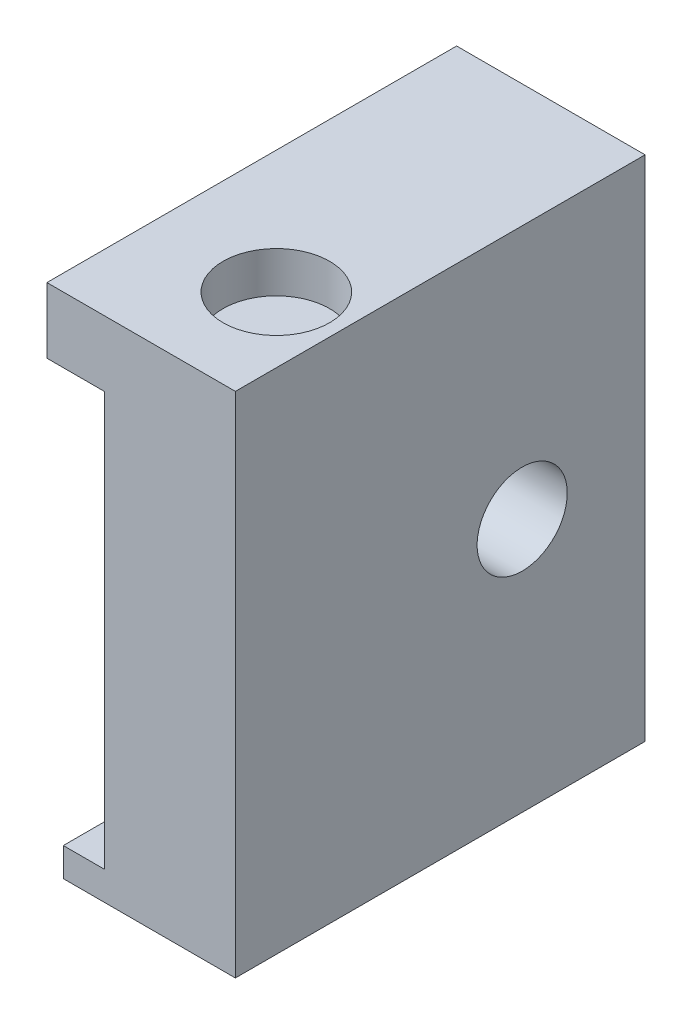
SolidWorks part; units mm, degrees
ref_plane "Face" through (0, 0, 0) normal (0, 0, 1) x (1, 0, 0)
ref_plane "Dessus" through (0, 0, 0) normal (0, 1, 0) x (1, 0, 0)
ref_plane "Droite" through (0, 0, 0) normal (1, 0, 0) x (0, 0, -1)
sketch "Esquisse1" plane through (0, 0, 0) normal (0, 0, 1) x (1, 0, 0)
  line L0 (0, 62) -> (0, 0)
  line L1 (-21, 3.5) -> (-16, 3.5)
  line L2 (-16, 54) -> (-16, 3.5)
  line L7 (-16, 54) -> (-23, 54)
  line L8 (-23, 54) -> (-23, 62)
  line L9 (-23, 62) -> (0, 62)
  line L10 (-21, 3.5) -> (-21, 0)
  line L11 (-21, 0) -> (0, 0)
  dimension "D1" = 23
  dimension "D2" = 16
  dimension "D4" = 21
  dimension "D6" = 62
  dimension "D7" = 8
  dimension "D8" = 50.5
extrude "Base-Extrusion" add sketch "Esquisse1" against normal blind 50
sketch "Esquisse2" plane through (-16, 0, 0) normal (-1, 0, 0) x (0, 0, 1)
  line L0 (-35, 65.6495) -> (-35, -7.1385) construction
  line L1 (-60.1909, 31) -> (14.4018, 31) construction
  line L2 (-50, 0) -> (0, 0) construction
  line L3 (0, 54) -> (0, 3.5) construction
  circle A0 centre (-35, 31) radius 5.5
  dimension "D3" = 11
  dimension "D1" = 31
  dimension "D2" = 35
extrude "Enlèv. mat.-Extru.1" cut sketch "Esquisse2" against normal blind 50
sketch "Esquisse3" plane through (0, 62, 0) normal (0, 1, 0) x (-1, 0, 0)
  line L0 (29.11, -13) -> (-14.0661, -13) construction
  line L1 (8, -45.2782) -> (8, 3.0402) construction
  line L2 (0, -50) -> (0, 0) construction
  line L3 (0, 0) -> (23, 0) construction
  circle A0 centre (8, -13) radius 6.5
  dimension "D3" = 13
  dimension "D1" = 8
  dimension "D2" = 13
extrude "Enlèv. mat.-Extru.2" cut sketch "Esquisse3" against normal blind 5
